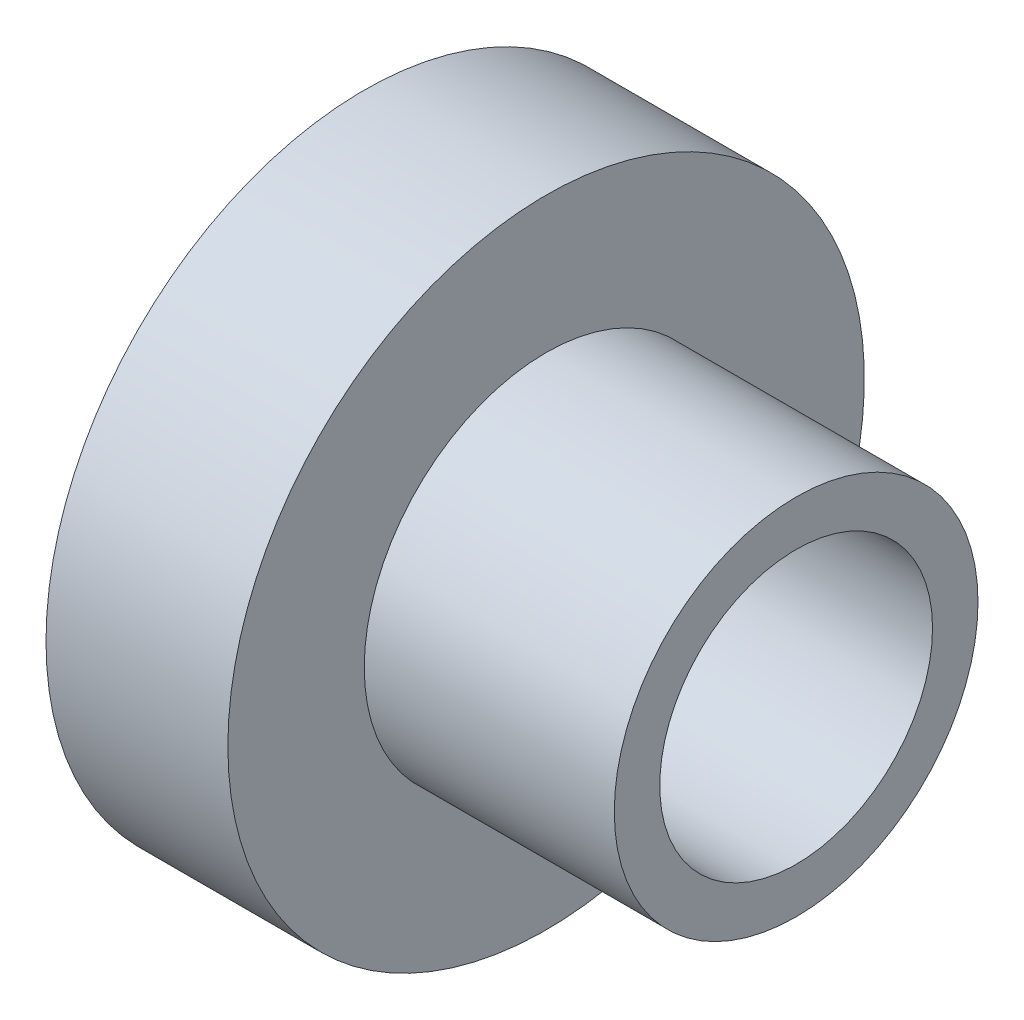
SolidWorks part; units mm, degrees
ref_plane "Front" through (0, 0, 0) normal (0, 0, 1) x (1, 0, 0)
ref_plane "Top" through (0, 0, 0) normal (0, 1, 0) x (1, 0, 0)
ref_plane "Right" through (0, 0, 0) normal (1, 0, 0) x (0, 0, -1)
sketch "Sketch1" plane through (0, 0, 0) normal (0, 1, 0) x (1, 0, 0)
  line L0 (0, 0) -> (9.5, 0)
  line L1 (9.5, 0) -> (9.5, 4)
  line L2 (9.5, 4) -> (4, 4)
  line L3 (4, 4) -> (4, 7)
  line L4 (4, 7) -> (0, 7)
  line L5 (0, 7) -> (0, 0)
revolve "Revolve1" add sketch "Sketch1" angle 360 about L0
sketch "Sketch2" plane through (9.5, 0, 0) normal (1, 0, 0) x (0, 0, -1)
  circle A0 centre (0, 0) radius 3
extrude "Cut-Extrude1" cut sketch "Sketch2" against normal through all
